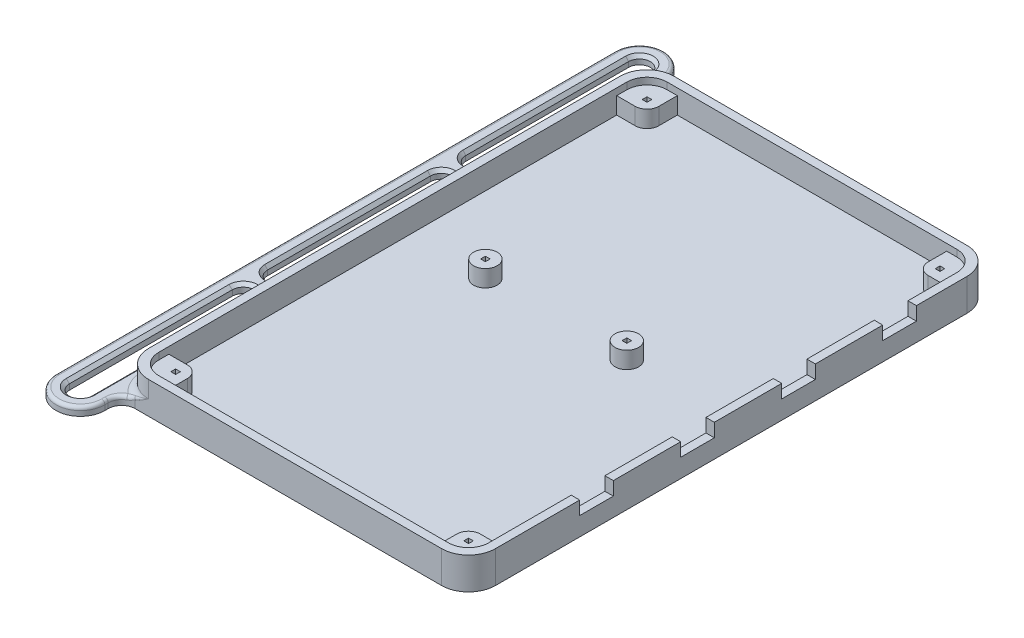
SolidWorks part; units mm, degrees
ref_plane "Спереди" through (0, 0, 0) normal (0, 0, 1) x (1, 0, 0)
ref_plane "Сверху" through (0, 0, 0) normal (0, 1, 0) x (1, 0, 0)
ref_plane "Справа" through (0, 0, 0) normal (1, 0, 0) x (0, 0, -1)
sketch "Эскиз1" plane through (0, 0, 0) normal (0, 1, 0) x (1, 0, 0)
  line L0 (40, 70) -> (40, 75.5)
  line L1 (-49, -75.5) -> (49, -75.5)
  line L2 (-49, -75.5) -> (-49, 75.5)
  line L3 (-49, 75.5) -> (49, 75.5)
  line L4 (49, -75.5) -> (49, 75.5)
  line L5 (-49, -75.5) -> (49, 75.5) construction
  line L6 (-49, 75.5) -> (49, -75.5) construction
  line L7 (-51.5, -78) -> (51.5, -78)
  line L8 (-51.5, -78) -> (-51.5, 78)
  line L9 (-51.5, 78) -> (51.5, 78)
  line L10 (51.5, -78) -> (51.5, 78)
  line L11 (-51.5, -78) -> (51.5, 78) construction
  line L12 (-51.5, 78) -> (51.5, -78) construction
  line L13 (42.7929, 69.2929) -> (44.2071, 69.2929)
  line L14 (42.7929, 69.2929) -> (42.7929, 70.7071)
  line L15 (42.7929, 70.7071) -> (44.2071, 70.7071)
  line L16 (44.2071, 69.2929) -> (44.2071, 70.7071)
  line L17 (42.7929, 69.2929) -> (44.2071, 70.7071) construction
  line L18 (42.7929, 70.7071) -> (44.2071, 69.2929) construction
  line L19 (43.5, 66.5) -> (49, 66.5)
  line L20 (0, 0) -> (49, 0) construction
  line L21 (0, 0) -> (0, 75.5) construction
  line L22 (-40, 70) -> (-40, 75.5)
  line L23 (-43.5, 66.5) -> (-49, 66.5)
  line L24 (-42.7929, 70.7071) -> (-44.2071, 70.7071)
  line L25 (-44.2071, 69.2929) -> (-44.2071, 70.7071)
  line L26 (-42.7929, 69.2929) -> (-44.2071, 69.2929)
  line L27 (-42.7929, 69.2929) -> (-42.7929, 70.7071)
  line L28 (40, -70) -> (40, -75.5)
  line L29 (43.5, -66.5) -> (49, -66.5)
  line L30 (42.7929, -70.7071) -> (44.2071, -70.7071)
  line L31 (44.2071, -69.2929) -> (44.2071, -70.7071)
  line L32 (42.7929, -69.2929) -> (44.2071, -69.2929)
  line L33 (42.7929, -69.2929) -> (42.7929, -70.7071)
  line L34 (-43.5, -66.5) -> (-49, -66.5)
  line L35 (-42.7929, -69.2929) -> (-42.7929, -70.7071)
  line L36 (-42.7929, -69.2929) -> (-44.2071, -69.2929)
  line L37 (-44.2071, -69.2929) -> (-44.2071, -70.7071)
  line L38 (-42.7929, -70.7071) -> (-44.2071, -70.7071)
  line L39 (-40, -70) -> (-40, -75.5)
  line L42 (-27.2071, 4.2929) -> (-25.7929, 4.2929)
  line L43 (-27.2071, 4.2929) -> (-27.2071, 5.7071)
  line L44 (-27.2071, 5.7071) -> (-25.7929, 5.7071)
  line L45 (-25.7929, 4.2929) -> (-25.7929, 5.7071)
  line L46 (-27.2071, 4.2929) -> (-25.7929, 5.7071) construction
  line L47 (-27.2071, 5.7071) -> (-25.7929, 4.2929) construction
  line L50 (14.7929, 4.2929) -> (16.2071, 4.2929)
  line L51 (14.7929, 4.2929) -> (14.7929, 5.7071)
  line L52 (14.7929, 5.7071) -> (16.2071, 5.7071)
  line L53 (16.2071, 4.2929) -> (16.2071, 5.7071)
  line L54 (14.7929, 4.2929) -> (16.2071, 5.7071) construction
  line L55 (14.7929, 5.7071) -> (16.2071, 4.2929) construction
  circle A0 centre (43.5, 70) radius 1 construction
  circle A1 centre (43.5, 70) radius 3.5
  circle A2 centre (-43.5, 70) radius 1 construction
  circle A3 centre (-43.5, 70) radius 3.5
  circle A4 centre (43.5, -70) radius 1 construction
  circle A5 centre (43.5, -70) radius 3.5
  circle A6 centre (-43.5, -70) radius 1 construction
  circle A7 centre (-43.5, -70) radius 3.5
  circle A8 centre (-26.5, 5) radius 1 construction
  circle A9 centre (-26.5, 5) radius 3.5
  circle A10 centre (15.5, 5) radius 1 construction
  circle A11 centre (15.5, 5) radius 3.5
  point P0 (0, 0)
  point P6 (0, 0)
  dimension "D5" = 5.5
  dimension "D7" = 2
  dimension "D8" = 2.5
  dimension "D10" = 2
  dimension "D11" = 2.5
  dimension "D12" = 2
  dimension "D13" = 70.5
  dimension "D14" = 64.5
  dimension "D15" = 2.5
  dimension "D1" = 98
  dimension "D2" = 151
  dimension "D3" = 2.5
  dimension "D4" = 2.5
  dimension "D6" = 5.5
  dimension "D9" = 70.5
  dimension "D16" = 22.5
extrude "Бобышка-Вытянуть1" add sketch "Эскиз1" along normal blind 5 contours L7 L10 L9 L8 L4 L1 L2 L3 | A7 L35 L38 L37 L36 | A7 L34 L2 L1 L39 | A9 L45 L42 L43 L44 | A11 L53 L50 L51 L52 | A3 L27 L26 L25 L24 | A1 L19 L4 L3 L0 | A1 L16 L13 L14 L15 | L23 A3 L22 L3 L2 | L29 A5 L28 L1 L4 | A5 L33 L32 L31 L30
sketch "Эскиз2" plane through (0, 0, 0) normal (0, -1, 0) x (1, 0, 0)
  line L0 (-58.75, 83) -> (-58.75, -83) construction
  line L1 (51.5, 78) -> (-51.5, 78)
  line L2 (51.5, 78) -> (51.5, -78)
  line L3 (51.5, -78) -> (-51.5, -78)
  line L4 (-51.5, 78) -> (-51.5, -78)
  line L5 (-51.5, 83) -> (-51.5, -83)
  line L6 (-66, 83) -> (-66, -83)
  line L7 (-58.75, -83) -> (-58.75, -34.6667) construction
  line L8 (-62, -83) -> (-62, -34.6667)
  line L9 (-55.5, -83) -> (-55.5, -34.6667)
  line L10 (-58.75, -24.1667) -> (-58.75, 24.1667) construction
  line L11 (-62, -24.1667) -> (-62, 24.1667)
  line L12 (-55.5, -24.1667) -> (-55.5, 24.1667)
  line L13 (-58.75, 83) -> (-58.75, 34.6667) construction
  line L14 (-55.5, 83) -> (-55.5, 34.6667)
  line L15 (-62, 83) -> (-62, 34.6667)
  arc A0 (-51.5, 83) -> (-66, 83) centre (-58.75, 83) ccw
  arc A1 (-66, -83) -> (-51.5, -83) centre (-58.75, -83) ccw
  arc A2 (-62, -83) -> (-55.5, -83) centre (-58.75, -83) ccw
  arc A3 (-55.5, -34.6667) -> (-62, -34.6667) centre (-58.75, -34.6667) ccw
  arc A4 (-62, -24.1667) -> (-55.5, -24.1667) centre (-58.75, -24.1667) ccw
  arc A5 (-55.5, 24.1667) -> (-62, 24.1667) centre (-58.75, 24.1667) ccw
  arc A6 (-55.5, 83) -> (-62, 83) centre (-58.75, 83) ccw
  arc A7 (-62, 34.6667) -> (-55.5, 34.6667) centre (-58.75, 34.6667) ccw
  point P8 (-58.75, 0)
  point P13 (-58.75, -58.8333)
  point P20 (-58.75, 0)
  point P27 (-58.75, 58.8333)
  point P36 (-58.75, -31.4167)
  point P37 (-58.75, -27.4167)
  point P38 (-58.75, 27.4167)
  point P39 (-58.75, 31.4167)
  dimension "D6" = 4
  dimension "D1" = 4
  dimension "D2" = 6.5
  dimension "D3" = 4
  dimension "D4" = 4
  dimension "D5" = 4
  dimension "D7" = 5
  dimension "D8" = 5
extrude "Бобышка-Вытянуть2" add sketch "Эскиз2" along normal blind 2.5
sketch "Эскиз3" plane through (0, 5, 0) normal (0, 1, 0) x (1, 0, 0)
  line L0 (49, 75.5) -> (49, -75.5)
  line L1 (51.5, 78) -> (-51.5, 78)
  line L2 (51.5, 78) -> (51.5, -78)
  line L3 (51.5, -78) -> (-51.5, -78)
  line L4 (-51.5, 78) -> (-51.5, -78)
  line L5 (49, -75.5) -> (-49, -75.5)
  line L6 (-49, 75.5) -> (-49, -75.5)
  line L7 (49, 75.5) -> (-49, 75.5)
  dimension "D1" = 2.5
extrude "Бобышка-Вытянуть3" add sketch "Эскиз3" along normal blind 2
fillet "Скругление3" radius 4 2 edges at (-51.5, -1.25, -78) (-51.5, -1.25, 78)
fillet "Скругление5" radius 8 2 edges at (51.5, 2.25, -78) (51.5, 2.25, 78)
fillet "Скругление7" radius 8 1 edges at (-51.5, 3.5, -78)
fillet "Скругление8" radius 8 1 edges at (-51.5, 3.5, 78)
fillet "Скругление9" radius 2 3 edges at (-49.1569, 0, 75.6569) (-49.1569, 0, -75.6569) (-51.5, 0, 0)
fillet "Скругление10" radius 1 11 edges at (-50.8333, 0, 79.7889) (-51.5, 0, 82.5) (-58.75, 0, 90.25) (-66, 0, 0) (-58.75, 0, -90.25) (-51.5, 0, -82.5) (-50.8333, 0, -79.7889) (-48.7578, 0.0165, 78.2029) (-48.0848, 0.1427, -78.043)
chamfer "Фаска1" distance 1 angle 40 12 edges at (-58.75, 0, 86.25) (-62, 0, 58.8333) (-58.75, 0, 31.4167) (-55.5, 0, 58.8333) (-58.75, 0, 27.4167) (-62, 0, 0) (-55.5, 0, 0) (-58.75, 0, -27.4167) (-58.75, 0, -31.4167) (-62, 0, -58.8333) (-58.75, 0, -86.25) (-55.5, 0, -58.8333)
fillet "Скругление11" radius 6 4 edges at (-49, 6, 75.5) (49, 6, 75.5) (49, 6, -75.5) (-49, 6, -75.5)
sketch "Эскиз4" plane through (49, 0, 0) normal (-1, 0, 0) x (0, 0, 1)
  line L0 (69.5, 7) -> (-69.5, 7) construction
  line L1 (-55, 7) -> (-45, 7)
  line L2 (-55, 7) -> (-55, 3)
  line L3 (-55, 3) -> (-45, 3)
  line L4 (-45, 7) -> (-45, 3)
  line L5 (-75.5, 5) -> (-75.5, 7) construction
  line L6 (-25, 7) -> (-15, 7)
  line L7 (-25, 7) -> (-25, 3)
  line L8 (-25, 3) -> (-15, 3)
  line L9 (-15, 7) -> (-15, 3)
  line L10 (5, 7) -> (15, 7)
  line L11 (5, 7) -> (5, 3)
  line L12 (5, 3) -> (15, 3)
  line L13 (15, 7) -> (15, 3)
  line L14 (35, 7) -> (45, 7)
  line L15 (35, 7) -> (35, 3)
  line L16 (35, 3) -> (45, 3)
  line L17 (45, 7) -> (45, 3)
  dimension "D1" = 20.5
  dimension "D2" = 10
  dimension "D3" = 4
  dimension "D5" = 20
  dimension "D4" = 4
extrude "Вырез-Вытянуть1" cut sketch "Эскиз4" against normal blind 10
